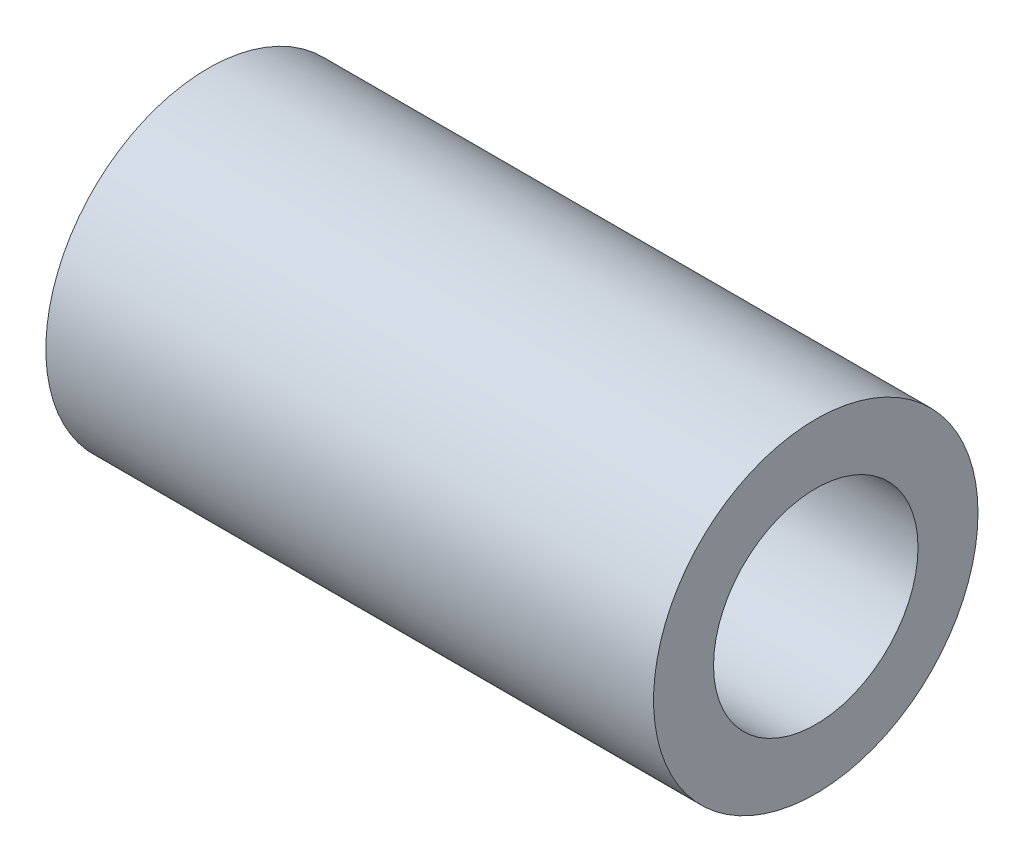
SolidWorks part; units mm, degrees
ref_plane "Front Plane" through (0, 0, 0) normal (0, 0, 1) x (1, 0, 0)
ref_plane "Top Plane" through (0, 0, 0) normal (0, 1, 0) x (1, 0, 0)
ref_plane "Right Plane" through (0, 0, 0) normal (1, 0, 0) x (0, 0, -1)
sketch "Sketch1" plane through (0, 0, 0) normal (1, 0, 0) x (0, 0, -1)
  circle A0 centre (0, 0) radius 15.113
  circle A1 centre (0, 0) radius 9.525
  dimension "D1" = 30.226
  dimension "D2" = 19.05
extrude "Extrude1" add sketch "Sketch1" along normal mid plane 56.6166
